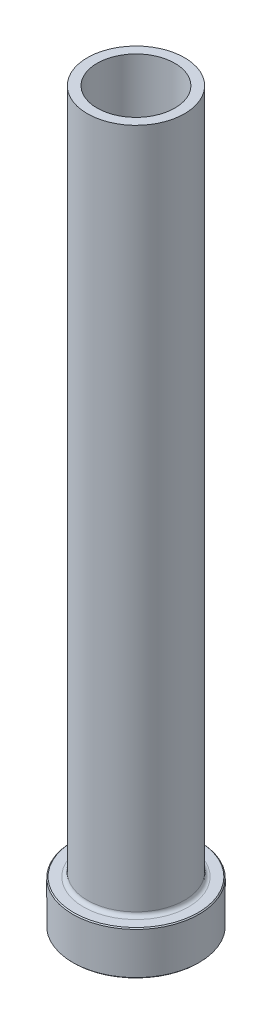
SolidWorks part; units mm, degrees
ref_plane "Front Plane" through (0, 0, 0) normal (0, 0, 1) x (1, 0, 0)
ref_plane "Top Plane" through (0, 0, 0) normal (0, 1, 0) x (1, 0, 0)
ref_plane "Right Plane" through (0, 0, 0) normal (1, 0, 0) x (0, 0, -1)
sketch "Sketch1" plane through (0, 0, 0) normal (0, 0, 1) x (1, 0, 0)
  line L0 (-8, 150) -> (-10, 150)
  line L1 (-10, 150) -> (-10, 9)
  line L2 (-10, 9) -> (-13, 9)
  line L3 (-13, 9) -> (-13, 0)
  line L4 (14.3, 0) -> (-14.3, 0) construction
  line L5 (-13, 0) -> (-8.25, 0)
  line L6 (-8, 95) -> (-8, 150)
  line L7 (0, 92.1877) -> (0, -15.5353) construction
  line L8 (0, -14.3) -> (0, 14.3) construction
  line L9 (-8, 95) -> (-8.25, 83)
  line L10 (-8.25, 83) -> (-8.25, 0)
  dimension "D1" = 0.25
  dimension "ID" = 16
  dimension "OD" = 20
  dimension "L" = 150
  dimension "H" = 26
  dimension "T" = 9
  dimension "N" = 55
  dimension "D2" = 12
revolve "Revolve1" add sketch "Sketch1" angle 360 about L7
fillet "Fillet1" radius 0.8 1 edges at (0, 9, 10)
chamfer "Chamfer1" distance 0.2 angle 45 2 edges at (0, 9, 13) (0, 0, 13)
chamfer "Chamfer3" distance 0.5 angle 45 1 edges at (0, 0, 8.25)
